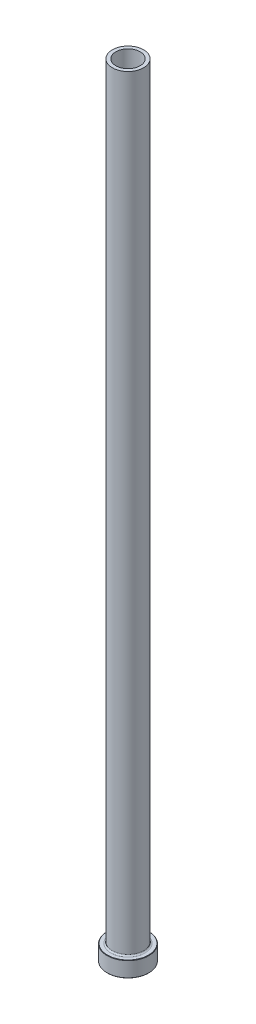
SolidWorks part; units mm, degrees
ref_plane "Front Plane" through (0, 0, 0) normal (0, 0, 1) x (1, 0, 0)
ref_plane "Top Plane" through (0, 0, 0) normal (0, 1, 0) x (1, 0, 0)
ref_plane "Right Plane" through (0, 0, 0) normal (1, 0, 0) x (0, 0, -1)
sketch "Sketch1" plane through (0, 0, 0) normal (0, 0, 1) x (1, 0, 0)
  line L0 (-7, 450) -> (-9, 450)
  line L1 (-9, 450) -> (-9, 9)
  line L2 (-9, 9) -> (-12, 9)
  line L3 (-12, 9) -> (-12, 0)
  line L4 (13.2, 0) -> (-13.2, 0) construction
  line L5 (-12, 0) -> (-7.25, 0)
  line L6 (-7, 395) -> (-7, 450)
  line L7 (0, 92.1877) -> (0, -15.5353) construction
  line L8 (0, -13.2) -> (0, 13.2) construction
  line L9 (-7, 395) -> (-7.25, 383)
  line L10 (-7.25, 383) -> (-7.25, 0)
  dimension "D1" = 0.25
  dimension "ID" = 14
  dimension "OD" = 18
  dimension "L" = 450
  dimension "H" = 24
  dimension "T" = 9
  dimension "N" = 55
  dimension "D2" = 12
revolve "Revolve1" add sketch "Sketch1" angle 360 about L7
fillet "Fillet1" radius 0.8 1 edges at (0, 9, 9)
chamfer "Chamfer1" distance 0.2 angle 45 2 edges at (0, 9, 12) (0, 0, 12)
chamfer "Chamfer3" distance 0.5 angle 45 1 edges at (0, 0, 7.25)
